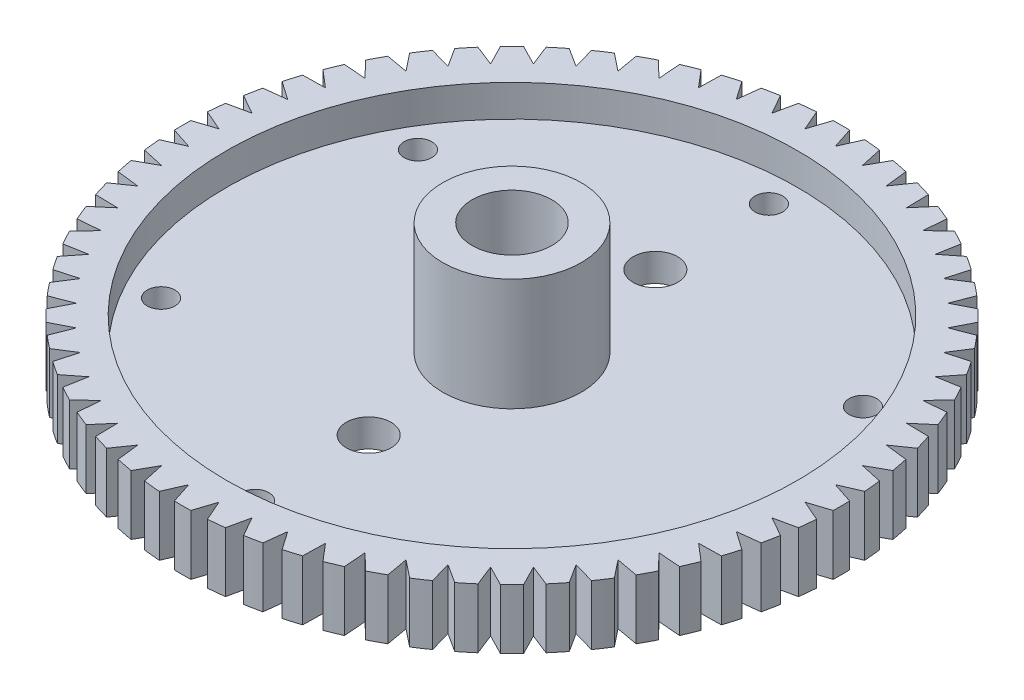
SolidWorks part; units mm, degrees
ref_plane "Front Plane" through (0, 0, 0) normal (0, 0, 1) x (1, 0, 0)
ref_plane "Top Plane" through (0, 0, 0) normal (0, 1, 0) x (1, 0, 0)
ref_plane "Right Plane" through (0, 0, 0) normal (1, 0, 0) x (0, 0, -1)
sketch "Sketch1" plane through (0, 0, 0) normal (0, 1, 0) x (1, 0, 0)
  line L0 (-1.2087, 24.5702) -> (-0.657, 26.2662)
  line L1 (1.2054, 24.5703) -> (1.9207, 26.2041)
  line L2 (0.657, 26.2674) -> (1.2054, 24.5703)
  line L3 (3.2285, 26.0766) -> (3.6079, 24.3339)
  line L4 (3.6079, 24.3339) -> (4.4799, 25.8897)
  line L5 (5.7689, 25.6346) -> (5.9757, 23.8631)
  line L6 (5.9757, 23.8631) -> (6.996, 25.3259)
  line L7 (8.2538, 24.9457) -> (8.2859, 23.1624)
  line L8 (8.2859, 23.1624) -> (9.4447, 24.5182)
  line L9 (10.6591, 24.0165) -> (10.5163, 22.2387)
  line L10 (10.5163, 22.2387) -> (11.8024, 23.4744)
  line L11 (12.9618, 22.8561) -> (12.6455, 21.1009)
  line L12 (12.6455, 21.1009) -> (14.0465, 22.2046)
  line L13 (15.1397, 21.4756) -> (14.6528, 19.7598)
  line L14 (14.6528, 19.7598) -> (16.1552, 20.7209)
  line L15 (17.1718, 19.8882) -> (16.5191, 18.2284)
  line L16 (16.5191, 18.2284) -> (18.1085, 19.0376)
  line L17 (19.0385, 18.1093) -> (18.2262, 16.5215)
  line L18 (18.2262, 16.5215) -> (19.8873, 17.171)
  line L19 (20.7218, 16.156) -> (19.7578, 14.6555)
  line L20 (19.7578, 14.6555) -> (21.4746, 15.139)
  line L21 (22.2056, 14.0471) -> (21.0992, 12.6483)
  line L22 (21.0992, 12.6483) -> (22.855, 12.9612)
  line L23 (23.4755, 11.803) -> (22.2373, 10.5193)
  line L24 (22.2373, 10.5193) -> (24.0154, 10.6586)
  line L25 (24.5194, 9.4451) -> (23.1613, 8.289)
  line L26 (23.1613, 8.289) -> (24.9445, 8.2534)
  line L27 (25.3271, 6.9963) -> (23.8623, 5.9789)
  line L28 (23.8623, 5.9789) -> (25.6333, 5.7687)
  line L29 (25.8909, 4.4801) -> (24.3334, 3.6112)
  line L30 (24.3334, 3.6112) -> (26.0753, 3.2284)
  line L31 (26.2054, 1.9208) -> (24.5702, 1.2087)
  line L32 (24.5702, 1.2087) -> (26.2662, 0.657)
  line L33 (26.2674, -0.657) -> (24.5703, -1.2054)
  line L34 (24.5703, -1.2054) -> (26.2041, -1.9207)
  line L35 (26.0766, -3.2285) -> (24.3339, -3.6079)
  line L36 (24.3339, -3.6079) -> (25.8897, -4.4799)
  line L37 (25.6346, -5.7689) -> (23.8631, -5.9757)
  line L38 (23.8631, -5.9757) -> (25.3259, -6.996)
  line L39 (24.9457, -8.2538) -> (23.1624, -8.2859)
  line L40 (23.1624, -8.2859) -> (24.5182, -9.4447)
  line L41 (24.0165, -10.6591) -> (22.2387, -10.5163)
  line L42 (22.2387, -10.5163) -> (23.4744, -11.8024)
  line L43 (22.8561, -12.9618) -> (21.1009, -12.6455)
  line L44 (21.1009, -12.6455) -> (22.2046, -14.0465)
  line L45 (21.4756, -15.1397) -> (19.7598, -14.6528)
  line L46 (19.7598, -14.6528) -> (20.7209, -16.1552)
  line L47 (19.8882, -17.1718) -> (18.2284, -16.5191)
  line L48 (18.2284, -16.5191) -> (19.0376, -18.1085)
  line L49 (18.1093, -19.0385) -> (16.5215, -18.2262)
  line L50 (16.5215, -18.2262) -> (17.171, -19.8873)
  line L51 (16.156, -20.7218) -> (14.6555, -19.7578)
  line L52 (14.6555, -19.7578) -> (15.139, -21.4746)
  line L53 (14.0471, -22.2056) -> (12.6483, -21.0992)
  line L54 (12.6483, -21.0992) -> (12.9612, -22.855)
  line L55 (11.803, -23.4755) -> (10.5193, -22.2373)
  line L56 (10.5193, -22.2373) -> (10.6586, -24.0154)
  line L57 (9.4451, -24.5194) -> (8.289, -23.1613)
  line L58 (8.289, -23.1613) -> (8.2534, -24.9445)
  line L59 (6.9963, -25.3271) -> (5.9789, -23.8623)
  line L60 (5.9789, -23.8623) -> (5.7687, -25.6333)
  line L61 (4.4801, -25.8909) -> (3.6112, -24.3334)
  line L62 (3.6112, -24.3334) -> (3.2284, -26.0753)
  line L63 (1.9208, -26.2054) -> (1.2087, -24.5702)
  line L64 (1.2087, -24.5702) -> (0.657, -26.2662)
  line L65 (-0.657, -26.2674) -> (-1.2054, -24.5703)
  line L66 (-1.2054, -24.5703) -> (-1.9207, -26.2041)
  line L67 (-3.2285, -26.0766) -> (-3.6079, -24.3339)
  line L68 (-3.6079, -24.3339) -> (-4.4799, -25.8897)
  line L69 (-5.7689, -25.6346) -> (-5.9757, -23.8631)
  line L70 (-5.9757, -23.8631) -> (-6.996, -25.3259)
  line L71 (-8.2538, -24.9457) -> (-8.2859, -23.1624)
  line L72 (-8.2859, -23.1624) -> (-9.4447, -24.5182)
  line L73 (-10.6591, -24.0165) -> (-10.5163, -22.2387)
  line L74 (-10.5163, -22.2387) -> (-11.8024, -23.4744)
  line L75 (-12.9618, -22.8561) -> (-12.6455, -21.1009)
  line L76 (-12.6455, -21.1009) -> (-14.0465, -22.2046)
  line L77 (-15.1397, -21.4756) -> (-14.6528, -19.7598)
  line L78 (-14.6528, -19.7598) -> (-16.1552, -20.7209)
  line L79 (-17.1718, -19.8882) -> (-16.5191, -18.2284)
  line L80 (-16.5191, -18.2284) -> (-18.1085, -19.0376)
  line L81 (-19.0385, -18.1093) -> (-18.2262, -16.5215)
  line L82 (-18.2262, -16.5215) -> (-19.8873, -17.171)
  line L83 (-20.7218, -16.156) -> (-19.7578, -14.6555)
  line L84 (-19.7578, -14.6555) -> (-21.4746, -15.139)
  line L85 (-22.2056, -14.0471) -> (-21.0992, -12.6483)
  line L86 (-21.0992, -12.6483) -> (-22.855, -12.9612)
  line L87 (-23.4755, -11.803) -> (-22.2373, -10.5193)
  line L88 (-22.2373, -10.5193) -> (-24.0154, -10.6586)
  line L89 (-24.5194, -9.4451) -> (-23.1613, -8.289)
  line L90 (-23.1613, -8.289) -> (-24.9445, -8.2534)
  line L91 (-25.3271, -6.9963) -> (-23.8623, -5.9789)
  line L92 (-23.8623, -5.9789) -> (-25.6333, -5.7687)
  line L93 (-25.8909, -4.4801) -> (-24.3334, -3.6112)
  line L94 (-24.3334, -3.6112) -> (-26.0753, -3.2284)
  line L95 (-26.2054, -1.9208) -> (-24.5702, -1.2087)
  line L96 (-24.5702, -1.2087) -> (-26.2662, -0.657)
  line L97 (-26.2674, 0.657) -> (-24.5703, 1.2054)
  line L98 (-24.5703, 1.2054) -> (-26.2041, 1.9207)
  line L99 (-26.0766, 3.2285) -> (-24.3339, 3.6079)
  line L100 (-24.3339, 3.6079) -> (-25.8897, 4.4799)
  line L101 (-25.6346, 5.7689) -> (-23.8631, 5.9757)
  line L102 (-23.8631, 5.9757) -> (-25.3259, 6.996)
  line L103 (-24.9457, 8.2538) -> (-23.1624, 8.2859)
  line L104 (-23.1624, 8.2859) -> (-24.5182, 9.4447)
  line L105 (-24.0165, 10.6591) -> (-22.2387, 10.5163)
  line L106 (-22.2387, 10.5163) -> (-23.4744, 11.8024)
  line L107 (-22.8561, 12.9618) -> (-21.1009, 12.6455)
  line L108 (-21.1009, 12.6455) -> (-22.2046, 14.0465)
  line L109 (-21.4756, 15.1397) -> (-19.7598, 14.6528)
  line L110 (-19.7598, 14.6528) -> (-20.7209, 16.1552)
  line L111 (-19.8882, 17.1718) -> (-18.2284, 16.5191)
  line L112 (-18.2284, 16.5191) -> (-19.0376, 18.1085)
  line L113 (-18.1093, 19.0385) -> (-16.5215, 18.2262)
  line L114 (-16.5215, 18.2262) -> (-17.171, 19.8873)
  line L115 (-16.156, 20.7218) -> (-14.6555, 19.7578)
  line L116 (-14.6555, 19.7578) -> (-15.139, 21.4746)
  line L117 (-14.0471, 22.2056) -> (-12.6483, 21.0992)
  line L118 (-12.6483, 21.0992) -> (-12.9612, 22.855)
  line L119 (-11.803, 23.4755) -> (-10.5193, 22.2373)
  line L120 (-10.5193, 22.2373) -> (-10.6586, 24.0154)
  line L121 (-9.4451, 24.5194) -> (-8.289, 23.1613)
  line L122 (-8.289, 23.1613) -> (-8.2534, 24.9445)
  line L123 (-6.9963, 25.3271) -> (-5.9789, 23.8623)
  line L124 (-5.9789, 23.8623) -> (-5.7687, 25.6333)
  line L125 (-4.4801, 25.8909) -> (-3.6112, 24.3334)
  line L126 (-3.6112, 24.3334) -> (-3.2284, 26.0753)
  line L127 (-1.9208, 26.2054) -> (-1.2087, 24.5702)
  circle A0 centre (0, 0) radius 25.4 construction
  circle A1 centre (0, 0) radius 3.175
  circle A2 centre (0, 0) radius 20.4851 construction
  circle A3 centre (0, 20.4851) radius 1.1049
  circle A4 centre (17.7406, 10.2426) radius 1.1049
  circle A5 centre (17.7406, -10.2425) radius 1.1049
  circle A6 centre (0, -20.4851) radius 1.1049
  circle A7 centre (-17.7406, -10.2426) radius 1.1049
  circle A8 centre (-17.7406, 10.2425) radius 1.1049
  circle A9 centre (0, 0) radius 24.5999 construction
  arc A10 (-0.657, 26.2662) -> (0.657, 26.2674) centre (0.0245, 0.075) cw
  arc A11 (1.9207, 26.2041) -> (3.2285, 26.0766) centre (0.0318, 0.0722) cw
  arc A12 (4.4799, 25.8897) -> (5.7689, 25.6346) centre (0.0387, 0.0688) cw
  arc A13 (6.996, 25.3259) -> (8.2538, 24.9457) centre (0.0452, 0.0646) cw
  arc A14 (9.4447, 24.5182) -> (10.6591, 24.0165) centre (0.0514, 0.0599) cw
  arc A15 (11.8024, 23.4744) -> (12.9618, 22.8561) centre (0.057, 0.0546) cw
  arc A16 (14.0465, 22.2046) -> (15.1397, 21.4756) centre (0.0621, 0.0487) cw
  arc A17 (16.1552, 20.7209) -> (17.1718, 19.8882) centre (0.0665, 0.0424) cw
  arc A18 (18.1085, 19.0376) -> (19.0385, 18.1093) centre (0.0704, 0.0357) cw
  arc A19 (19.8873, 17.171) -> (20.7218, 16.156) centre (0.0735, 0.0286) cw
  arc A20 (21.4746, 15.139) -> (22.2056, 14.0471) centre (0.076, 0.0213) cw
  arc A21 (22.855, 12.9612) -> (23.4755, 11.803) centre (0.0777, 0.0137) cw
  arc A22 (24.0154, 10.6586) -> (24.5194, 9.4451) centre (0.0787, 0.006) cw
  arc A23 (24.9445, 8.2534) -> (25.3271, 6.9963) centre (0.0789, -0.0017) cw
  arc A24 (25.6333, 5.7687) -> (25.8909, 4.4801) centre (0.0783, -0.0094) cw
  arc A25 (26.0753, 3.2284) -> (26.2054, 1.9208) centre (0.077, -0.0171) cw
  arc A26 (26.2662, 0.657) -> (26.2674, -0.657) centre (0.075, -0.0245) cw
  arc A27 (26.2041, -1.9207) -> (26.0766, -3.2285) centre (0.0722, -0.0318) cw
  arc A28 (25.8897, -4.4799) -> (25.6346, -5.7689) centre (0.0688, -0.0387) cw
  arc A29 (25.3259, -6.996) -> (24.9457, -8.2538) centre (0.0646, -0.0452) cw
  arc A30 (24.5182, -9.4447) -> (24.0165, -10.6591) centre (0.0599, -0.0514) cw
  arc A31 (23.4744, -11.8024) -> (22.8561, -12.9618) centre (0.0546, -0.057) cw
  arc A32 (22.2046, -14.0465) -> (21.4756, -15.1397) centre (0.0487, -0.0621) cw
  arc A33 (20.7209, -16.1552) -> (19.8882, -17.1718) centre (0.0424, -0.0665) cw
  arc A34 (19.0376, -18.1085) -> (18.1093, -19.0385) centre (0.0357, -0.0704) cw
  arc A35 (17.171, -19.8873) -> (16.156, -20.7218) centre (0.0286, -0.0735) cw
  arc A36 (15.139, -21.4746) -> (14.0471, -22.2056) centre (0.0213, -0.076) cw
  arc A37 (12.9612, -22.855) -> (11.803, -23.4755) centre (0.0137, -0.0777) cw
  arc A38 (10.6586, -24.0154) -> (9.4451, -24.5194) centre (0.006, -0.0787) cw
  arc A39 (8.2534, -24.9445) -> (6.9963, -25.3271) centre (-0.0017, -0.0789) cw
  arc A40 (5.7687, -25.6333) -> (4.4801, -25.8909) centre (-0.0094, -0.0783) cw
  arc A41 (3.2284, -26.0753) -> (1.9208, -26.2054) centre (-0.0171, -0.077) cw
  arc A42 (0.657, -26.2662) -> (-0.657, -26.2674) centre (-0.0245, -0.075) cw
  arc A43 (-1.9207, -26.2041) -> (-3.2285, -26.0766) centre (-0.0318, -0.0722) cw
  arc A44 (-4.4799, -25.8897) -> (-5.7689, -25.6346) centre (-0.0387, -0.0688) cw
  arc A45 (-6.996, -25.3259) -> (-8.2538, -24.9457) centre (-0.0452, -0.0646) cw
  arc A46 (-9.4447, -24.5182) -> (-10.6591, -24.0165) centre (-0.0514, -0.0599) cw
  arc A47 (-11.8024, -23.4744) -> (-12.9618, -22.8561) centre (-0.057, -0.0546) cw
  arc A48 (-14.0465, -22.2046) -> (-15.1397, -21.4756) centre (-0.0621, -0.0487) cw
  arc A49 (-16.1552, -20.7209) -> (-17.1718, -19.8882) centre (-0.0665, -0.0424) cw
  arc A50 (-18.1085, -19.0376) -> (-19.0385, -18.1093) centre (-0.0704, -0.0357) cw
  arc A51 (-19.8873, -17.171) -> (-20.7218, -16.156) centre (-0.0735, -0.0286) cw
  arc A52 (-21.4746, -15.139) -> (-22.2056, -14.0471) centre (-0.076, -0.0213) cw
  arc A53 (-22.855, -12.9612) -> (-23.4755, -11.803) centre (-0.0777, -0.0137) cw
  arc A54 (-24.0154, -10.6586) -> (-24.5194, -9.4451) centre (-0.0787, -0.006) cw
  arc A55 (-24.9445, -8.2534) -> (-25.3271, -6.9963) centre (-0.0789, 0.0017) cw
  arc A56 (-25.6333, -5.7687) -> (-25.8909, -4.4801) centre (-0.0783, 0.0094) cw
  arc A57 (-26.0753, -3.2284) -> (-26.2054, -1.9208) centre (-0.077, 0.0171) cw
  arc A58 (-26.2662, -0.657) -> (-26.2674, 0.657) centre (-0.075, 0.0245) cw
  arc A59 (-26.2041, 1.9207) -> (-26.0766, 3.2285) centre (-0.0722, 0.0318) cw
  arc A60 (-25.8897, 4.4799) -> (-25.6346, 5.7689) centre (-0.0688, 0.0387) cw
  arc A61 (-25.3259, 6.996) -> (-24.9457, 8.2538) centre (-0.0646, 0.0452) cw
  arc A62 (-24.5182, 9.4447) -> (-24.0165, 10.6591) centre (-0.0599, 0.0514) cw
  arc A63 (-23.4744, 11.8024) -> (-22.8561, 12.9618) centre (-0.0546, 0.057) cw
  arc A64 (-22.2046, 14.0465) -> (-21.4756, 15.1397) centre (-0.0487, 0.0621) cw
  arc A65 (-20.7209, 16.1552) -> (-19.8882, 17.1718) centre (-0.0424, 0.0665) cw
  arc A66 (-19.0376, 18.1085) -> (-18.1093, 19.0385) centre (-0.0357, 0.0704) cw
  arc A67 (-17.171, 19.8873) -> (-16.156, 20.7218) centre (-0.0286, 0.0735) cw
  arc A68 (-15.139, 21.4746) -> (-14.0471, 22.2056) centre (-0.0213, 0.076) cw
  arc A69 (-12.9612, 22.855) -> (-11.803, 23.4755) centre (-0.0137, 0.0777) cw
  arc A70 (-10.6586, 24.0154) -> (-9.4451, 24.5194) centre (-0.006, 0.0787) cw
  arc A71 (-8.2534, 24.9445) -> (-6.9963, 25.3271) centre (0.0017, 0.0789) cw
  arc A72 (-5.7687, 25.6333) -> (-4.4801, 25.8909) centre (0.0094, 0.0783) cw
  arc A73 (-3.2284, 26.0753) -> (-1.9208, 26.2054) centre (0.0171, 0.077) cw
  point P19 (0, 0)
  point P23 (0, 26.2751)
  point P343 (0, 0)
  dimension "D1" = 50.8
  dimension "D2" = 6.35
  dimension "D3" = 2.2098
  dimension "D4" = 40.9702
  dimension "D6" = 49.1998
  dimension "D7" = 26.2001
  dimension "D5" = 6
  dimension "D8" = 64
extrude "Boss-Extrude1" add sketch "Sketch1" along normal blind 4.7625
sketch "Sketch2" plane through (0, 0, 0) normal (0, 1, 0) x (1, 0, 0)
  circle A0 centre (0, 0) radius 5.5245
  circle A1 centre (0, 0) radius 3.175
  dimension "D1" = 11.049
extrude "Boss-Extrude2" add sketch "Sketch2" along normal blind 11.176
sketch "Sketch3" plane through (0, 4.7625, 0) normal (0, 1, 0) x (1, 0, 0)
  circle A0 centre (0, 0) radius 22.7711
  circle A1 centre (0, 0) radius 5.5245 construction
  circle A2 centre (0, 0) radius 5.5245
  dimension "D1" = 45.5422
extrude "Cut-Extrude2" cut sketch "Sketch3" against normal blind 2.54
sketch "Sketch4" plane through (0, 2.2225, 0) normal (0, 1, 0) x (1, 0, 0)
  line L0 (0, 20.4851) -> (0, -20.4851) construction
  line L1 (0, 0) -> (14.3766, 0) construction
  circle A4 centre (0, 11.43) radius 1.778
  circle A5 centre (0, -11.43) radius 1.778
  point P11 (0, -11.43)
  point P12 (0, 11.43)
  dimension "D1" = 22.86
  dimension "D2" = 3.556
extrude "Cut-Extrude3" cut sketch "Sketch4" against normal through all
